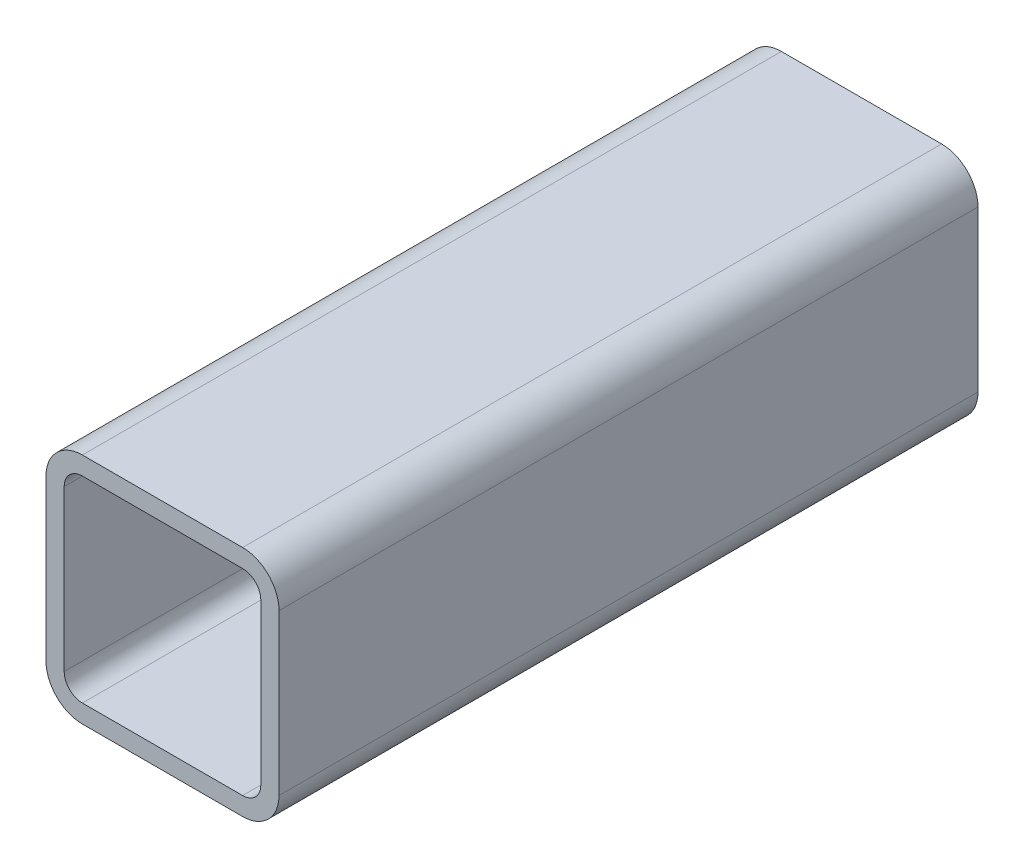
SolidWorks part; units mm, degrees
ref_plane "Front Plane" through (0, 0, 0) normal (0, 0, 1) x (1, 0, 0)
ref_plane "Top Plane" through (0, 0, 0) normal (0, 1, 0) x (1, 0, 0)
ref_plane "Right Plane" through (0, 0, 0) normal (1, 0, 0) x (0, 0, -1)
sketch "Sketch1" plane through (0, 0, 0) normal (0, 0, 1) x (1, 0, 0)
sketch_block_instance "HSS4x4x0.3125-1"
sketch_block "HSS4x4x0.3125"
extrude "Boss-Extrude1" add sketch "Sketch1" along normal blind 304.8
